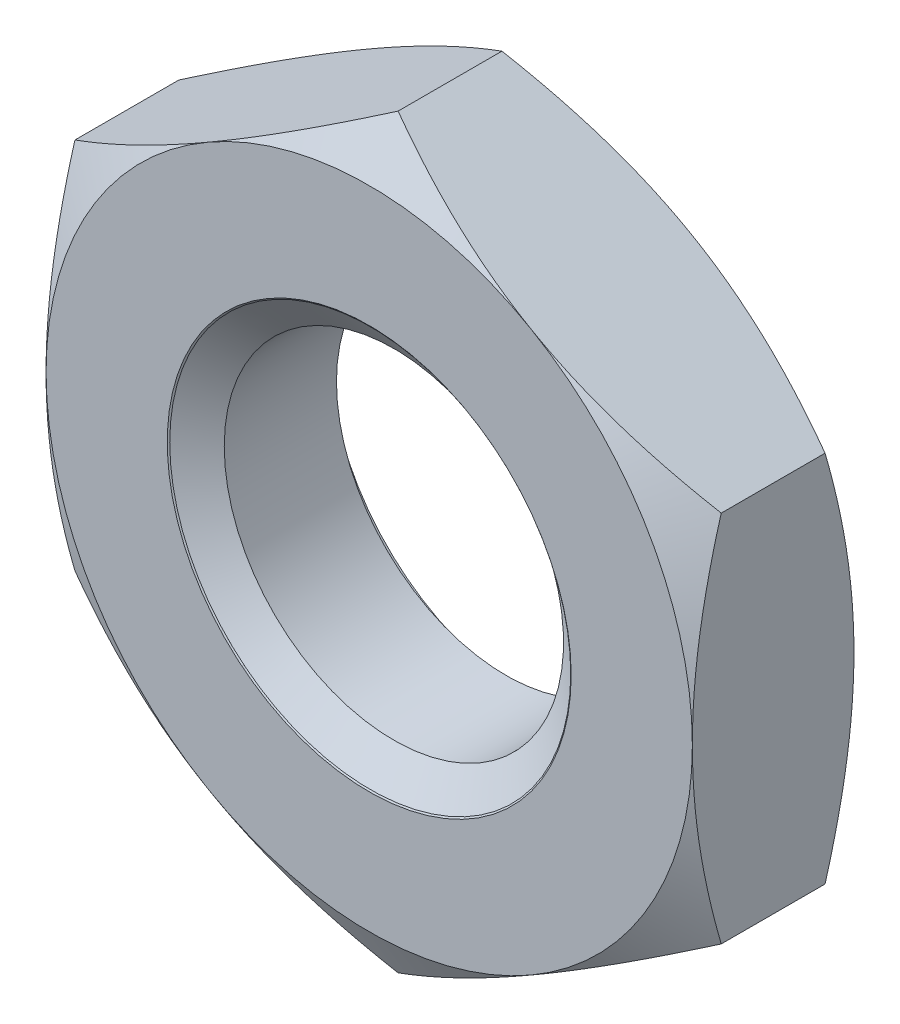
SolidWorks part; units mm, degrees
ref_plane "Plane1" through (0, 0, 0) normal (0, 0, 1) x (1, 0, 0)
ref_plane "Plane2" through (0, 0, 0) normal (0, 1, 0) x (1, 0, 0)
ref_plane "Plane3" through (0, 0, 0) normal (1, 0, 0) x (0, 0, -1)
revolve "EndChamfer" cut sketch "Sketch5"
sketch "Sketch5"
  line L0 (1.9746, 2.5) -> (1.6665, 2.06)
  line L1 (2.0254, 2.5) -> (1.9746, 2.5)
  line L2 (2.0254, 2.5) -> (2.0254, 2.06)
  line L3 (2.0254, 2.06) -> (1.6665, 2.06)
  line L6 (-0.0508, 2.5) -> (0, 2.5)
  line L7 (0, 2.5) -> (0.3081, 2.06)
  line L9 (0.3081, 2.06) -> (-0.0508, 2.06)
  line L10 (-0.0508, 2.06) -> (-0.0508, 2.5)
  line L11 (25.0375, 0) -> (38.388, 0) construction
  line L12 (2, 0) -> (0, 0) construction
extrude "BaseNut" add sketch "BaseNutSke" against normal blind 2
sketch "BaseNutSke" plane through (0, 0, 0) normal (0, 0, 1) x (1, 0, 0)
  line L6 (4, 2.3094) -> (4, -2.3094)
  line L7 (-4, 2.3094) -> (-4, -2.3094)
  line L8 (4, 2.3094) -> (0, 4.6188)
  line L9 (0, 4.6188) -> (-4, 2.3094)
  line L10 (-4, -2.3094) -> (0, -4.6188)
  line L11 (0, -4.6188) -> (4, -2.3094)
  circle A0 centre (0, 0) radius 2.1
  dimension "D4" = 4
  dimension "Tap_drill" = 4.2
  dimension "D1" = 120
  dimension "D2" = 4
  dimension "D3" = 4
  dimension "Width_flats" = 8
pattern_linear "ThdSchPat" [suppressed]
revolve "ThreadSchematic" cut sketch "ThdSchSke" angle 360 about L6
sketch "ThdSchSke" plane through (0, 0, 0) normal (0, 1, 0) x (1, 0, 0)
  line L0 (-2.5, 0.0254) -> (-2.1, 0.3055)
  line L1 (-2.1, 0.3055) -> (-1.05, 0.3055)
  line L2 (-1.05, 0.3055) -> (-1.05, -0.2547)
  line L3 (-1.05, -0.2547) -> (-2.1, -0.2547)
  line L4 (-2.1, -0.2547) -> (-2.5, 0.0254)
  line L5 (-3.175, 0.8) -> (3.175, 0.8) construction
  line L6 (0, 0.8) -> (0, -2.9874) construction
  line L7 (0, 1.6945) -> (0, 0.2801) construction
  dimension "D1" = 0.0254
  dimension "VeeAngle" = 70
  dimension "SideAngle" = 55
  dimension "OverCut" = 2.1
  dimension "Tap_Drill" = 4.2
  dimension "Advance" = 0.8
  dimension "Thread_major" = 5
sketch "Sketch3" plane through (0, 0, 0) normal (1, 0, 0) x (0, 0, -1)
  line L0 (2, 4) -> (1.6427, 4.6188)
  line L1 (1.6427, 4.6188) -> (1.6427, 14.6188)
  line L2 (1.6427, 14.6188) -> (12, 14.6188)
  line L3 (12, 14.6188) -> (12, 4)
  line L4 (12, 4) -> (2, 4)
  line L5 (2, 2.3094) -> (2, 4.6188) construction
  line L6 (2, 4.6188) -> (0, 4.6188) construction
  line L7 (0, 0) -> (38.6776, 0) construction
  line L8 (2, 0) -> (0, 0) construction
  line L9 (1, 4.6188) -> (1, 44.222) construction
  line L10 (0.3573, 14.6188) -> (-10, 14.6188)
  line L11 (-10, 14.6188) -> (-10, 4)
  line L12 (-10, 4) -> (0, 4)
  line L13 (0, 4) -> (0.3573, 4.6188)
  line L14 (0.3573, 4.6188) -> (0.3573, 14.6188)
  line L16 (2, 4.6188) -> (0, 4.6188) construction
  dimension "D1" = 4
  dimension "D2" = 30
  dimension "D3" = 10
  dimension "D4" = 10
revolve "Double-Chamfer" cut sketch "Sketch3" angle 360 about L7
equation "\"D2@BaseNutSke\" = \"Width_flats@BaseNutSke\" / 2"
equation "\"D3@BaseNutSke\" = \"Width_flats@BaseNutSke\" / 2"
equation "\"D1@Sketch3\" = \"Width_flats@BaseNutSke\" /2"
equation "\"D4@BaseNutSke\" = \"D3@BaseNutSke\""
equation "\"Thread_major@ThdSchSke\" = \"Thread_major@ThreadCosmetic\""
equation "\"Tap_drill@ThdSchSke\" = \"Tap_drill@BaseNutSke\""
equation "\"Overcut@ThdSchSke\" = \"Tap_drill@ThdSchSke\" * 0.5"
equation "\"Num_threads@ThdSchPat\" = int(  ( \"Thickness@BaseNut\" - 0.0508 ) / \"Advance@ThdSchSke\" + 0.999 )  + 1"
equation "\"Advance@ThdSchPat\" = ( \"Thickness@BaseNut\" - 0.0508 ) /  (\"Num_threads@ThdSchPat\" - 1) 'relax it"
equation "' \"Num_threads@ThdSchPat\" = \"Num_threads@ThdSchPat\" - sgn( \"Num_threads@ThdSchPat\" - 1) '---chamfered tips only---"
equation "\"ThreadMajor@Sketch5\" = \"Thread_major@ThreadCosmetic\" * 0.5"
equation "\"ChamferDepth@Sketch5\" = (\"Thread_major@ThreadCosmetic\" - \"Tap_drill@BaseNutSke\") * 0.55"
equation "\"Offset1@Sketch5\" = \"Thickness@BaseNut\" + 0.0254"
equation "\"Offset2@Sketch5\" = \"Offset1@Sketch5\" + 0.0508"
